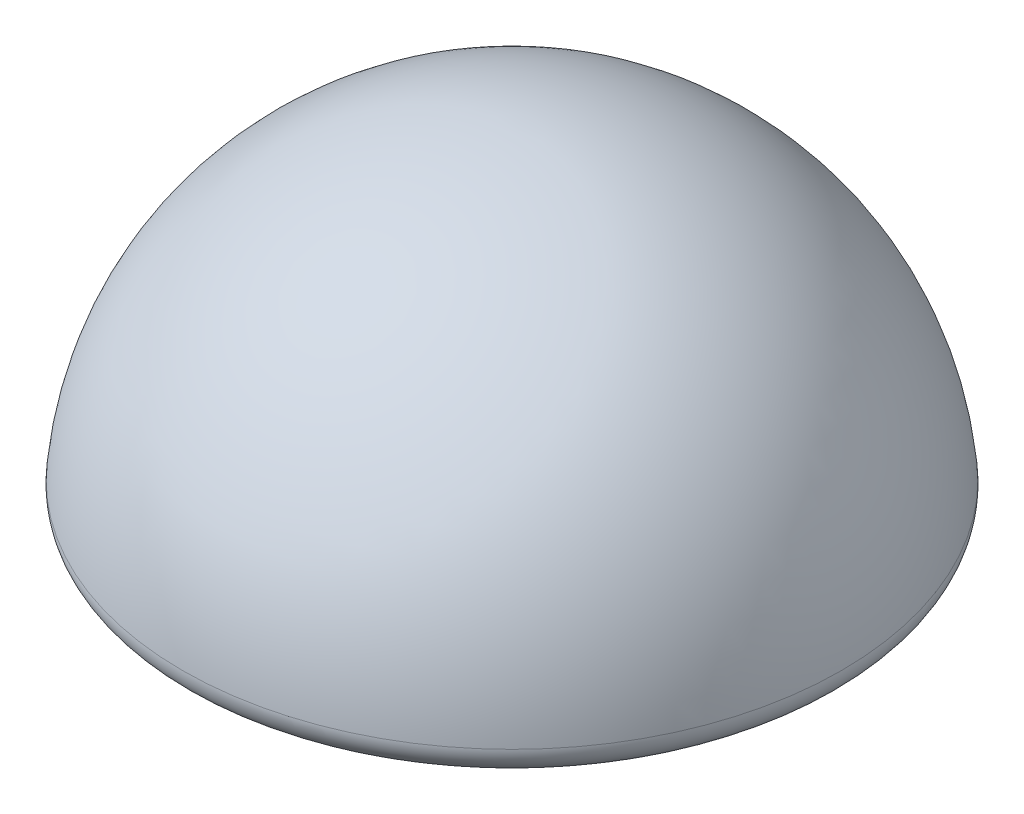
SolidWorks part; units mm, degrees
ref_plane "Front Plane" through (0, 0, 0) normal (0, 0, 1) x (1, 0, 0)
ref_plane "Top Plane" through (0, 0, 0) normal (0, 1, 0) x (1, 0, 0)
ref_plane "Right Plane" through (0, 0, 0) normal (1, 0, 0) x (0, 0, -1)
sketch "Sketch1" plane through (0, 0, 0) normal (0, 0, 1) x (1, 0, 0)
  line L0 (0, 0) -> (0, 25)
  line L1 (0, 0) -> (25, 0)
  arc A0 (0, 25) -> (25, 0) centre (0, 0) cw
  dimension "D1" = 25
  dimension "D2" = 25
revolve "Revolve1" add sketch "Sketch1" angle 360 about L0
sketch "Sketch2" plane through (0, 0, 0) normal (0, -1, 0) x (1, 0, 0)
  circle A0 centre (0, 0) radius 12.25
  dimension "D1" = 24.5
extrude "Cut-Extrude1" cut sketch "Sketch2" against normal blind 16
fillet "Fillet2" radius 2 1 edges at (0, 0, -25)
